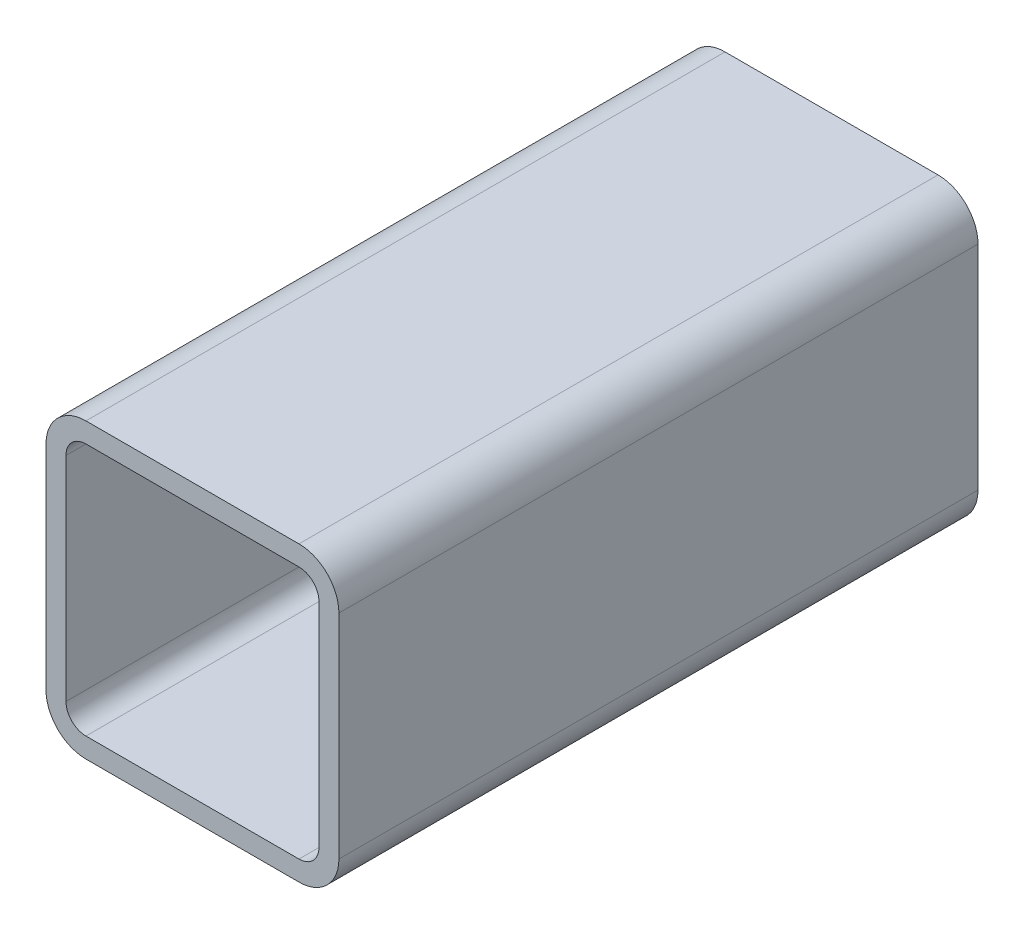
SolidWorks part; units mm, degrees
ref_plane "Front Plane" through (0, 0, 0) normal (0, 0, 1) x (1, 0, 0)
ref_plane "Top Plane" through (0, 0, 0) normal (0, 1, 0) x (1, 0, 0)
ref_plane "Right Plane" through (0, 0, 0) normal (1, 0, 0) x (0, 0, -1)
sketch "Sketch1" plane through (0, 0, 0) normal (0, 0, 1) x (1, 0, 0)
sketch_block_instance "HSS5.5x5.5x0.375-1"
sketch_block "HSS5.5x5.5x0.375"
extrude "Boss-Extrude1" add sketch "Sketch1" along normal blind 304.8
